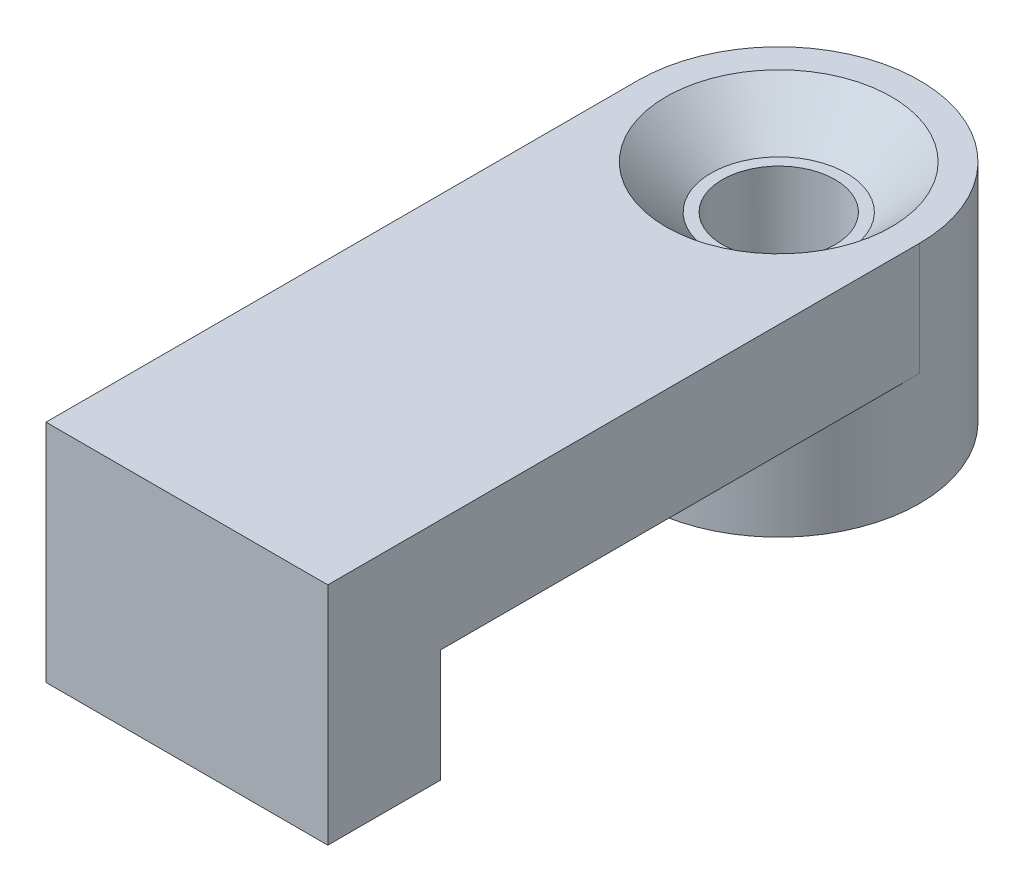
SolidWorks part; units mm, degrees
ref_plane "Ebene vorne" through (0, 0, 0) normal (0, 0, 1) x (1, 0, 0)
ref_plane "Ebene oben" through (0, 0, 0) normal (0, 1, 0) x (1, 0, 0)
ref_plane "Ebene rechts" through (0, 0, 0) normal (1, 0, 0) x (0, 0, -1)
sketch "Skizze1" plane through (0, 0, 0) normal (0, 1, 0) x (1, 0, 0)
  circle A0 centre (0, 0) radius 1
  circle A1 centre (0, 0) radius 2.5
  dimension "D1" = 2
  dimension "D2" = 5
extrude "Aufsatz-Linear austragen1" add sketch "Skizze1" along normal blind 4
other "ErweiterteBohrung1" parameters "D1"=0
sketch "Skizze2" plane through (0, 4, 0) normal (0, 1, 0) x (1, 0, 0)
  point P0 (0, 0)
sketch "Skizze3" plane through (0, 4, 0) normal (0, 0, -1) x (1, 0, 0)
  line L0 (0, 0) -> (0, 0.7726)
  line L1 (0, -0.3863) -> (0, 1.1588) construction
  line L2 (2, 0) -> (1.2, 0.7726)
  line L3 (-2, 0) -> (-1.2, 0.7726) construction
  line L4 (0, 0) -> (2, 0)
  line L5 (1.2, 0.7726) -> (0, 0.7726)
  dimension "D1" = 0.7726
  dimension "D2" = 4
  dimension "D3" = 92
sketch "Skizze4" plane through (0, 4, 0) normal (0, 1, 0) x (1, 0, 0)
  line L0 (-2.5, 0) -> (-2.5, -8.5)
  line L1 (-55, 0) -> (55, 0) construction
  line L2 (-2.5, -8.5) -> (2.5, -8.5)
  line L3 (2.5, -8.5) -> (2.5, 0)
  circle A0 centre (0, 0) radius 2.5 construction
  arc A1 (-2.5, 0) -> (2.5, 0) centre (0, 0) ccw
  point P6 (0, 0)
  point P9 (2.5, 0)
  dimension "D1" = 8.5
extrude "Aufsatz-Linear austragen2" add sketch "Skizze4" against normal blind 2
sketch "Skizze5" plane through (0, 4, 0) normal (0, 1, 0) x (1, 0, 0)
  line L0 (2.5, -8.5) -> (2.5, 0) construction
  line L1 (-2.5, -8.5) -> (2.5, -8.5)
  line L2 (-2.5, -8.5) -> (-2.5, -10.5)
  line L3 (-2.5, -10.5) -> (2.5, -10.5)
  line L4 (2.5, -8.5) -> (2.5, -10.5)
  dimension "D1" = 2
extrude "Aufsatz-Linear austragen3" add sketch "Skizze5" against normal blind 4
